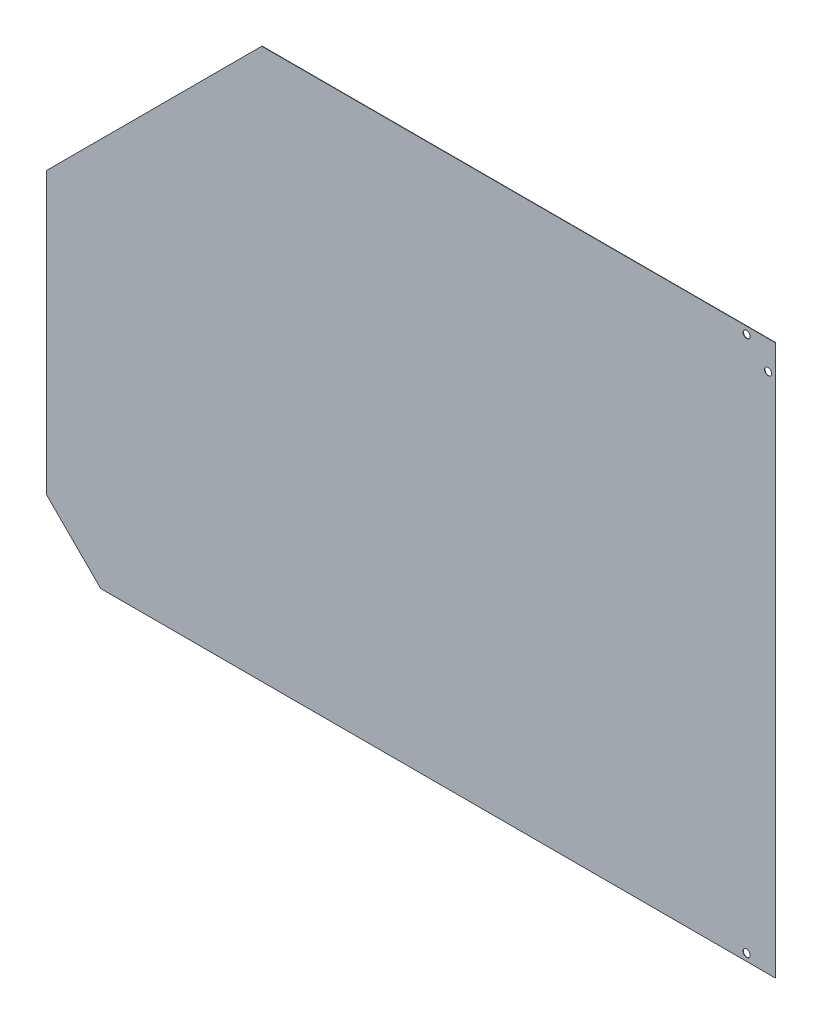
SolidWorks part; units mm, degrees
ref_plane "Plan de face" through (0, 0, 0) normal (0, 0, 1) x (1, 0, 0)
ref_plane "Plan de dessus" through (0, 0, 0) normal (0, 1, 0) x (1, 0, 0)
ref_plane "Plan de droite" through (0, 0, 0) normal (1, 0, 0) x (0, 0, -1)
sketch "Esquisse1" plane through (0, 0, 0) normal (0, 0, 1) x (1, 0, 0)
  line L0 (-718.58, 770) -> (-1020, 468.58)
  line L1 (0, 0) -> (-1020, 0)
  line L2 (0, 0) -> (0, 770)
  line L3 (0, 770) -> (-718.58, 770)
  line L4 (-1020, 0) -> (-1020, 468.58)
  point P1 (-1020, 770)
  dimension "D1" = 1020
  dimension "D2" = 770
  dimension "D6" = 301.42
extrude "Extrusion1" add sketch "Esquisse1" along normal blind 0.5
sketch "Esquisse3" plane through (0, 0, 0.5) normal (0, 0, 1) x (1, 0, 0)
  circle A0 centre (-40, 760) radius 4.9036
  circle A1 centre (-10, 730) radius 4.9731
extrude "Enlèv. mat.-Extru.1" cut sketch "Esquisse3" against normal blind 10
sketch "Esquisse4" plane through (0, 0, 0) normal (0, 0, -1) x (-1, 0, 0)
  line L0 (1020, 75.9629) -> (944.0371, 0)
  line L1 (1020, 468.58) -> (1020, 0) construction
  line L2 (1020, 0) -> (0, 0) construction
  line L3 (1020, 75.9629) -> (1020, 0)
  line L4 (1020, 0) -> (944.0371, 0)
extrude "Enlèv. mat.-Extru.2" cut sketch "Esquisse4" against normal blind 10
sketch "Esquisse5" plane through (0, 0, 0) normal (0, 0, -1) x (-1, 0, 0)
  circle A0 centre (40, 10) radius 5 construction
  circle A1 centre (40, 10) radius 5
extrude "Enlèv. mat.-Extru.3" cut sketch "Esquisse5" against normal blind 401
